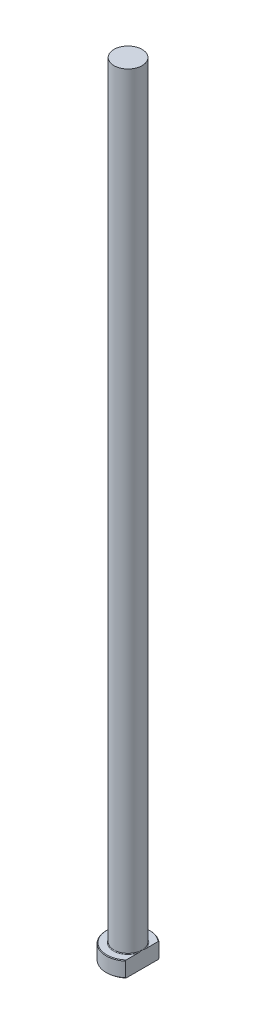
SolidWorks part; units mm, degrees
ref_plane "Front Plane" through (0, 0, 0) normal (0, 0, 1) x (1, 0, 0)
ref_plane "Top Plane" through (0, 0, 0) normal (0, 1, 0) x (1, 0, 0)
ref_plane "Right Plane" through (0, 0, 0) normal (1, 0, 0) x (0, 0, -1)
sketch "Sketch1" plane through (0, 0, 0) normal (0, 0, 1) x (1, 0, 0)
  line L0 (0, 259.9588) -> (0, -15.1925) construction
  line L1 (0, 0) -> (-7, 0)
  line L2 (-7, 0) -> (-7, 5)
  line L3 (-7, 5) -> (-4.5, 5)
  line L4 (-4.5, 5) -> (-4.5, 250)
  line L5 (-4.5, 250) -> (0, 250)
  line L6 (0, 250) -> (0, 0)
  dimension "L" = 250
  dimension "H" = 14
  dimension "T" = 5
  dimension "D" = 9
revolve "Revolve1" add sketch "Sketch1" angle 360 about L0
chamfer "Chamfer1" distance 0.2 angle 45 2 edges at (0, 5, 7) (0, 0, 7)
fillet "Fillet1" radius 0.2 1 edges at (0, 5, 4.5)
sketch "Sketch2" plane through (0, 0, 0) normal (0, 1, 0) x (1, 0, 0)
  line L0 (4.5, 5.3619) -> (4.5, -5.3619)
  circle A0 centre (0, 0) radius 7 construction
  arc A1 (4.5, -5.3619) -> (4.5, 5.3619) centre (0, 0) ccw
  circle A2 centre (0, 0) radius 4.5 construction
extrude "KEY" cut sketch "Sketch2" along normal through all
